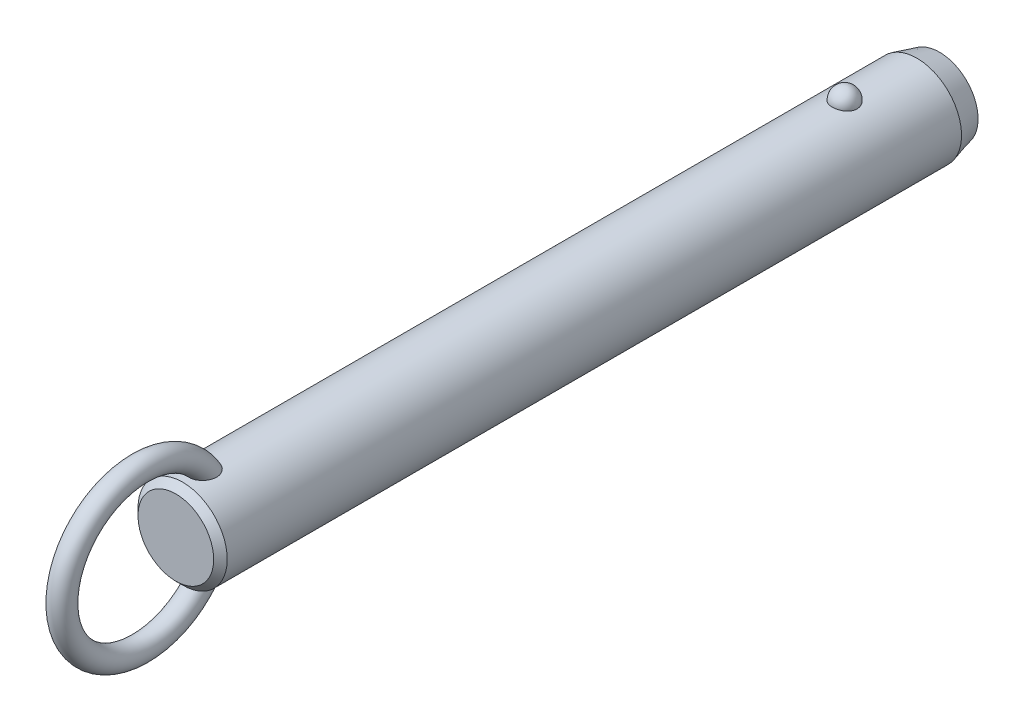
SolidWorks part; units mm, degrees
ref_plane "Front Plane" through (0, 0, 0) normal (0, 0, 1) x (1, 0, 0)
ref_plane "Top Plane" through (0, 0, 0) normal (0, 1, 0) x (1, 0, 0)
ref_plane "Right Plane" through (0, 0, 0) normal (1, 0, 0) x (0, 0, -1)
sketch "Sketch2" plane through (0, 0, 0) normal (0, 0, 1) x (1, 0, 0)
  circle A0 centre (0, 0) radius 7.9
  point P3 (0, 7.9)
  dimension "D1" = 15.8
extrude "Boss-Extrude1" add sketch "Sketch2" along normal blind 106.7
sketch "Sketch3" plane through (0, 0, 0) normal (0, 0, -1) x (-1, 0, 0)
  circle A0 centre (0, 0) radius 7.9
  dimension "D1" = 15.8
extrude "Boss-Extrude2" add sketch "Sketch3" along normal blind 19
chamfer "Chamfer1" distance 4 angle 15 1 edges at (-7.9, 0, -19)
sketch "Sketch12" plane through (0, 0, 0) normal (1, 0, 0) x (0, 0, -1)
  line L0 (-106.7, 7.9) -> (-106.7, -7.9) construction
  point P0 (-106.7, 0)
sketch "Sketch13" plane through (0, 0, 0) normal (1, 0, 0) x (0, 0, -1)
  circle A0 centre (-122.55, 0) radius 15.85
  point P2 (-106.7, 0)
  dimension "D1" = 31.7
sketch "Sketch14" plane through (0, 0, 0) normal (0, 1, 0) x (1, 0, 0)
  circle A0 centre (0, -108.7) radius 2
  point P2 (0, -106.7)
  dimension "D1" = 4
sweep "Sweep1" add profiles "Sketch14" path "Sketch13"
sketch "Sketch15" plane through (0, 0, 106.7) normal (0, 0, 1) x (1, 0, 0)
  circle A0 centre (0, 0) radius 7.9
  dimension "D1" = 15.8
extrude "Boss-Extrude3" add sketch "Sketch15" along normal blind 9.52
chamfer "Chamfer2" distance 1.2 angle 45 1 edges at (7.9, 0, 116.22)
sketch "Sketch18" plane through (0, 0, 0) normal (1, 0, 0) x (0, 0, -1)
  line L0 (15, 7.9) -> (-108.8091, 7.9) construction
  line L1 (2.2, 10.1) -> (2.2, 5.7)
  line L2 (-108.8091, -7.9) -> (15, -7.9) construction
  arc A0 (2.2, 10.1) -> (2.2, 5.7) centre (2.2, 7.9) ccw
  point P4 (0, 7.9)
  dimension "D1" = 18
revolve "Revolve1" add sketch "Sketch18" angle 360 about L1
